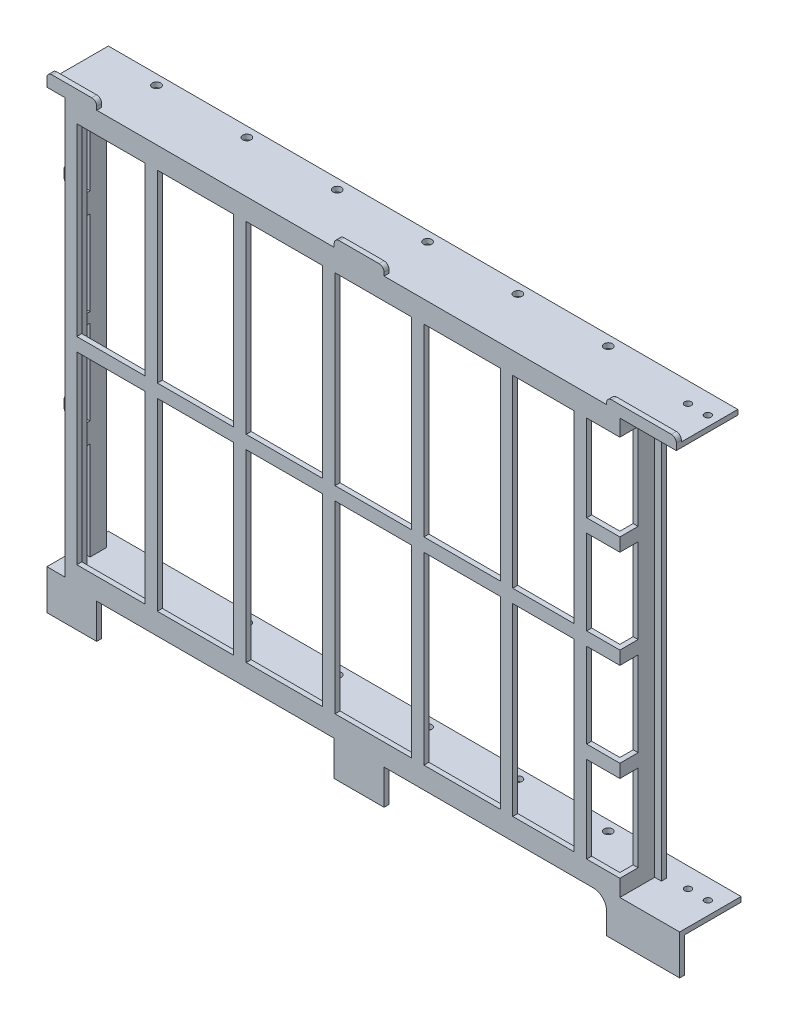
SolidWorks part; units mm, degrees
ref_plane "Plan de face" through (0, 0, 0) normal (0, 0, 1) x (1, 0, 0)
ref_plane "Plan de dessus" through (0, 0, 0) normal (0, 1, 0) x (1, 0, 0)
ref_plane "Plan de droite" through (0, 0, 0) normal (1, 0, 0) x (0, 0, -1)
sketch "Esquisse2" plane through (0, 0, 0) normal (0, 0, 1) x (1, 0, 0)
  line L0 (-80.4506, -55.1614) -> (-39.4506, -55.1614)
  line L1 (46.2661, 187.8386) -> (74.5494, 187.8386)
  line L2 (-87.4506, 184.8386) -> (-87.4506, -65.1614)
  line L3 (75.0494, -55.1614) -> (121.0494, -55.1614)
  line L4 (226.5494, 174.8386) -> (226.5494, 122.8386)
  line L5 (-80.4506, 174.8386) -> (-39.4506, 174.8386)
  line L6 (-80.4506, 174.8386) -> (-80.4506, 63.8386)
  line L7 (-31.9506, 174.8386) -> (14.0494, 174.8386)
  line L8 (219.0494, 174.8386) -> (219.0494, 63.8386)
  line L9 (219.0494, 55.8386) -> (182.0494, 55.8386)
  line L10 (21.5494, 174.8386) -> (67.5494, 174.8386)
  line L11 (219.0494, 63.8386) -> (182.0494, 63.8386)
  line L12 (74.5494, 187.8386) -> (74.5494, 189.8386)
  line L13 (77.5494, 192.8386) -> (101.5494, 192.8386)
  line L14 (67.5494, 174.8386) -> (67.5494, 63.8386)
  line L15 (104.5494, 187.8386) -> (104.5494, 189.8386)
  line L16 (75.0494, 174.8386) -> (75.0494, 63.8386)
  line L17 (-31.9506, -55.1614) -> (14.0494, -55.1614)
  line L18 (-39.4506, 174.8386) -> (-39.4506, 63.8386)
  line L20 (-31.9506, 174.8386) -> (-31.9506, 63.8386)
  line L22 (14.0494, 174.8386) -> (14.0494, 63.8386)
  line L24 (21.5494, 174.8386) -> (21.5494, 63.8386)
  line L25 (-39.4506, 63.8386) -> (-80.4506, 63.8386)
  line L26 (121.0494, 174.8386) -> (121.0494, 63.8386)
  line L27 (-39.4506, 55.8386) -> (-39.4506, -55.1614)
  line L28 (128.5494, 174.8386) -> (128.5494, 63.8386)
  line L30 (174.5494, 174.8386) -> (174.5494, 63.8386)
  line L31 (-31.9506, 55.8386) -> (-31.9506, -55.1614)
  line L32 (182.0494, 174.8386) -> (182.0494, 63.8386)
  line L33 (-39.4506, 55.8386) -> (-80.4506, 55.8386)
  line L34 (-80.4506, 55.8386) -> (-80.4506, -55.1614)
  line L35 (128.5494, -55.1614) -> (174.5494, -55.1614)
  line L36 (182.0494, -55.1614) -> (219.0494, -55.1614)
  line L37 (219.0494, 55.8386) -> (219.0494, -55.1614)
  line L38 (174.5494, 63.8386) -> (128.5494, 63.8386)
  line L39 (174.5494, 55.8386) -> (128.5494, 55.8386)
  line L40 (182.0494, 55.8386) -> (182.0494, -55.1614)
  line L41 (174.5494, 55.8386) -> (174.5494, -55.1614)
  line L42 (128.5494, 55.8386) -> (128.5494, -55.1614)
  line L43 (121.0494, 55.8386) -> (121.0494, -55.1614)
  line L44 (121.0494, 63.8386) -> (75.0494, 63.8386)
  line L45 (121.0494, 55.8386) -> (75.0494, 55.8386)
  line L46 (182.0494, 174.8386) -> (219.0494, 174.8386)
  line L47 (128.5494, 174.8386) -> (174.5494, 174.8386)
  line L48 (75.0494, 174.8386) -> (121.0494, 174.8386)
  line L50 (104.5494, 187.8386) -> (238.5494, 187.8386)
  line L51 (14.0494, 63.8386) -> (-31.9506, 63.8386)
  line L52 (21.5494, 55.8386) -> (21.5494, -55.1614)
  line L53 (14.0494, 55.8386) -> (-31.9506, 55.8386)
  line L54 (14.0494, 55.8386) -> (14.0494, -55.1614)
  line L55 (67.5494, 63.8386) -> (21.5494, 63.8386)
  line L56 (67.5494, 55.8386) -> (21.5494, 55.8386)
  line L57 (75.0494, 55.8386) -> (75.0494, -55.1614)
  line L58 (67.5494, 55.8386) -> (67.5494, -55.1614)
  line L59 (-68.4506, -68.1614) -> (74.5494, -68.1614)
  line L60 (21.5494, -55.1614) -> (67.5494, -55.1614)
  line L64 (46.2661, 187.8386) -> (-68.4506, 187.8386)
  line L68 (-87.4506, -65.1614) -> (-98.4506, -65.1614)
  line L69 (-98.4506, -65.1614) -> (-98.4506, -89.1614)
  line L70 (-98.4506, -89.1614) -> (-68.4506, -89.1614)
  line L71 (-98.4506, 189.8386) -> (-98.4506, 184.8386)
  line L72 (-95.4506, 192.8386) -> (-71.4506, 192.8386)
  line L73 (-68.4506, 189.8386) -> (-68.4506, 187.8386)
  line L75 (-68.4506, -89.1614) -> (-68.4506, -68.1614)
  line L76 (-98.4506, 184.8386) -> (-87.4506, 184.8386)
  line L79 (74.5494, -68.1614) -> (74.5494, -89.1614)
  line L80 (74.5494, -89.1614) -> (104.5494, -89.1614)
  line L81 (104.5494, -89.1614) -> (104.5494, -68.1614)
  line L83 (246.5494, 184.8386) -> (280.5494, 184.8386)
  line L84 (246.5494, 184.8386) -> (246.5494, 174.8386)
  line L85 (226.5494, 174.8386) -> (246.5494, 174.8386)
  line L86 (226.5494, -55.1614) -> (246.5494, -55.1614)
  line L87 (246.5494, -55.1614) -> (246.5494, -65.1614)
  line L88 (280.5494, 184.8386) -> (280.5494, 188.8386)
  line L89 (277.5494, 191.8386) -> (241.5494, 191.8386)
  line L90 (238.5494, 188.8386) -> (238.5494, 187.8386)
  line L91 (238.5494, -76.1614) -> (238.5494, -89.1614)
  line L92 (238.5494, -89.1614) -> (282.5494, -89.1614)
  line L93 (282.5494, -89.1614) -> (282.5494, -65.1614)
  line L94 (282.5494, -65.1614) -> (246.5494, -65.1614)
  line L95 (226.5494, 63.8386) -> (246.5494, 63.8386)
  line L96 (246.5494, 63.8386) -> (246.5494, 55.8386)
  line L97 (246.5494, 55.8386) -> (226.5494, 55.8386)
  line L98 (226.5494, 55.8386) -> (226.5494, 4.8386)
  line L99 (226.5494, 114.8386) -> (226.5494, 63.8386)
  line L100 (226.5494, 114.8386) -> (246.5494, 114.8386)
  line L101 (226.5494, -3.1614) -> (226.5494, -55.1614)
  line L102 (226.5494, 122.8386) -> (246.5494, 122.8386)
  line L103 (246.5494, 114.8386) -> (246.5494, 122.8386)
  line L104 (226.5494, 4.8386) -> (246.5494, 4.8386)
  line L105 (104.5494, -68.1614) -> (230.5494, -68.1614)
  line L106 (226.5494, -3.1614) -> (246.5494, -3.1614)
  line L107 (246.5494, 4.8386) -> (246.5494, -3.1614)
  arc A0 (241.5494, 191.8386) -> (238.5494, 188.8386) centre (241.5494, 188.8386) ccw
  arc A1 (277.5494, 191.8386) -> (280.5494, 188.8386) centre (277.5494, 188.8386) cw
  arc A2 (230.5494, -68.1614) -> (238.5494, -76.1614) centre (230.5494, -76.1614) cw
  arc A3 (74.5494, 189.8386) -> (77.5494, 192.8386) centre (77.5494, 189.8386) cw
  arc A4 (101.5494, 192.8386) -> (104.5494, 189.8386) centre (101.5494, 189.8386) cw
  arc A5 (-98.4506, 189.8386) -> (-95.4506, 192.8386) centre (-95.4506, 189.8386) cw
  arc A6 (-71.4506, 192.8386) -> (-68.4506, 189.8386) centre (-71.4506, 189.8386) cw
  point P82 (-98.4506, 192.8386)
  point P100 (280.5494, 191.8386)
  point P121 (74.5494, 192.8386)
  point P124 (104.5494, 192.8386)
  point P125 (-68.4506, 192.8386)
  dimension "D25" = 3
  dimension "D26" = 3
  dimension "D30" = 8
  dimension "D42" = 3
  dimension "D43" = 3
  dimension "D54" = 3
  dimension "D55" = 3
  dimension "D2" = 111
  dimension "D3" = 111
  dimension "D4" = 13
  dimension "D5" = 13
  dimension "D6" = 37
  dimension "D7" = 314
  dimension "D8" = 7.5
  dimension "D9" = 7.5
  dimension "D10" = 46
  dimension "D11" = 7.5
  dimension "D12" = 46
  dimension "D13" = 7.5
  dimension "D14" = 46
  dimension "D15" = 7.5
  dimension "D16" = 46
  dimension "D17" = 7.5
  dimension "D18" = 41
  dimension "D19" = 256
  dimension "D20" = 20
  dimension "D21" = 20
  dimension "D22" = 34
  dimension "D23" = 3
  dimension "D24" = 7
  dimension "D27" = 42
  dimension "D28" = 44
  dimension "D29" = 36
  dimension "D31" = 24
  dimension "D32" = 3
  dimension "D33" = 20
  dimension "D34" = 8
  dimension "D35" = 20
  dimension "D36" = 51
  dimension "D37" = 8
  dimension "D38" = 51
  dimension "D39" = 30
  dimension "D40" = 142
  dimension "D41" = 5
  dimension "D44" = 142
  dimension "D45" = 30
  dimension "D46" = 21
  dimension "D47" = 11
  dimension "D48" = 24
  dimension "D49" = 30
  dimension "D50" = 8
  dimension "D51" = 30
  dimension "D52" = 5
  dimension "D53" = 11
extrude "Boss.-Extru.1" add sketch "Esquisse2" along normal blind 3
sketch "Esquisse3" plane through (0, 0, 0) normal (0, 0, -1) x (-1, 0, 0)
  line L0 (98.4506, -65.1614) -> (98.4506, -89.1614) construction
  line L1 (-282.5494, -65.1614) -> (98.4506, -65.1614)
  line L2 (-282.5494, -65.1614) -> (-282.5494, -68.1614)
  line L3 (-282.5494, -68.1614) -> (98.4506, -68.1614)
  line L4 (98.4506, -65.1614) -> (98.4506, -68.1614)
  dimension "D1" = 3
extrude "Boss.-Extru.2" add sketch "Esquisse3" along normal blind 34
sketch "Esquisse4" plane through (0, 0, 0) normal (0, 0, -1) x (-1, 0, 0)
  line L0 (-280.5494, 184.8386) -> (-280.5494, 188.8386) construction
  line L1 (98.4506, 184.8386) -> (-280.5494, 184.8386)
  line L2 (98.4506, 184.8386) -> (98.4506, 187.8386)
  line L3 (98.4506, 187.8386) -> (-280.5494, 187.8386)
  line L4 (-280.5494, 184.8386) -> (-280.5494, 187.8386)
  dimension "D1" = 3
extrude "Boss.-Extru.3" add sketch "Esquisse4" along normal blind 34
sketch "Esquisse5" plane through (0, 0, 0) normal (0, 0, -1) x (-1, 0, 0)
  line L0 (87.4506, -65.1614) -> (-246.5494, -65.1614) construction
  line L1 (87.4506, 184.8386) -> (84.4506, 184.8386)
  line L2 (87.4506, 184.8386) -> (87.4506, -65.1614)
  line L3 (87.4506, -65.1614) -> (84.4506, -65.1614)
  line L4 (84.4506, 184.8386) -> (84.4506, -65.1614)
  dimension "D1" = 3
extrude "Boss.-Extru.4" add sketch "Esquisse5" along normal blind 7
sketch "Esquisse6" plane through (0, 0, 0) normal (0, 0, -1) x (-1, 0, 0)
  line L0 (-280.5494, 184.8386) -> (98.4506, 184.8386) construction
  line L1 (-246.5494, 174.8386) -> (-243.5494, 174.8386)
  line L2 (-246.5494, 174.8386) -> (-246.5494, 184.8386)
  line L3 (-246.5494, 184.8386) -> (-243.5494, 184.8386)
  line L4 (-243.5494, 174.8386) -> (-243.5494, 184.8386)
  line L5 (-246.5494, 122.8386) -> (-226.5494, 122.8386) construction
  line L6 (-246.5494, 114.8386) -> (-243.5494, 114.8386)
  line L7 (-246.5494, 114.8386) -> (-246.5494, 122.8386)
  line L8 (-246.5494, 122.8386) -> (-243.5494, 122.8386)
  line L9 (-243.5494, 114.8386) -> (-243.5494, 122.8386)
  line L10 (-226.5494, -3.1614) -> (-246.5494, -3.1614) construction
  line L11 (-246.5494, 55.8386) -> (-243.5494, 55.8386)
  line L12 (-246.5494, 55.8386) -> (-246.5494, 63.8386)
  line L13 (-246.5494, 63.8386) -> (-243.5494, 63.8386)
  line L14 (-243.5494, 55.8386) -> (-243.5494, 63.8386)
  line L15 (-246.5494, 4.8386) -> (-243.5494, 4.8386)
  line L16 (-246.5494, 4.8386) -> (-246.5494, -3.1614)
  line L17 (-246.5494, -3.1614) -> (-243.5494, -3.1614)
  line L18 (-243.5494, 4.8386) -> (-243.5494, -3.1614)
  line L19 (84.4506, -65.1614) -> (-246.5494, -65.1614) construction
  line L20 (-246.5494, -55.1614) -> (-243.5494, -55.1614)
  line L21 (-246.5494, -55.1614) -> (-246.5494, -65.1614)
  line L22 (-246.5494, -65.1614) -> (-243.5494, -65.1614)
  line L23 (-243.5494, -55.1614) -> (-243.5494, -65.1614)
  dimension "D1" = 3
extrude "Boss.-Extru.5" add sketch "Esquisse6" along normal blind 8
sketch "Esquisse7" plane through (0, 0, -8) normal (0, 0, -1) x (-1, 0, 0)
  line L0 (-280.5494, 184.8386) -> (98.4506, 184.8386) construction
  line L1 (-246.5494, -65.1614) -> (-243.5494, -65.1614)
  line L2 (-246.5494, -65.1614) -> (-246.5494, 184.8386)
  line L3 (-246.5494, 184.8386) -> (-243.5494, 184.8386)
  line L4 (-243.5494, -65.1614) -> (-243.5494, 184.8386)
  line L5 (-243.5494, 184.8386) -> (84.4506, 184.8386) construction
extrude "Boss.-Extru.6" add sketch "Esquisse7" along normal blind 13
sketch "Esquisse8" plane through (246.5494, 0, 0) normal (1, 0, 0) x (0, 0, -1)
  line L0 (-3, -65.1614) -> (21, -65.1614) construction
  line L1 (21, 184.8386) -> (18, 184.8386)
  line L2 (21, 184.8386) -> (21, -65.1614)
  line L3 (21, -65.1614) -> (18, -65.1614)
  line L4 (18, 184.8386) -> (18, -65.1614)
  dimension "D1" = 3
extrude "Boss.-Extru.7" add sketch "Esquisse8" along normal blind 4
sketch "Esquisse9" plane through (0, 184.8386, 0) normal (0, -1, 0) x (1, 0, 0)
  line L0 (280.5494, -34) -> (-98.4506, -34) construction
  line L1 (-93.4506, -22.3325) -> (-98.4506, -22.3325)
  line L2 (-93.4506, -22.3325) -> (-93.4506, -25)
  line L3 (-93.4506, -25) -> (-98.4506, -25)
  line L4 (-98.4506, -22.3325) -> (-98.4506, -25)
  line L5 (-98.4506, 3) -> (-98.4506, -34) construction
  dimension "D1" = 9
  dimension "D2" = 5
extrude "Boss.-Extru.8" add sketch "Esquisse9" along normal up to next
sketch "Esquisse10" plane through (-93.4506, 0, 0) normal (1, 0, 0) x (0, 0, -1)
  line L0 (-3, -65.1614) -> (18, -65.1614) construction
  line L1 (25, 184.8386) -> (15, 184.8386)
  line L2 (25, 184.8386) -> (25, -65.1614)
  line L3 (25, -65.1614) -> (15, -65.1614)
  line L4 (15, 184.8386) -> (15, -65.1614)
  dimension "D1" = 10
extrude "Boss.-Extru.9" add sketch "Esquisse10" along normal blind 3
sketch "Esquisse12" plane through (0, 0, -15) normal (0, 0, 1) x (1, 0, 0)
  line L0 (-93.4506, -65.1614) -> (-93.4506, 184.8386) construction
  line L1 (-93.4506, 5.8386) -> (-90.4506, 5.8386)
  line L2 (-93.4506, 5.8386) -> (-93.4506, -6.1614)
  line L3 (-93.4506, -6.1614) -> (-90.4506, -6.1614)
  line L4 (-90.4506, 5.8386) -> (-90.4506, -6.1614)
  line L5 (-90.4506, 184.8386) -> (-90.4506, -65.1614) construction
  line L6 (-98.4506, 184.8386) -> (-87.4506, 184.8386) construction
  line L7 (-93.4506, 62.8386) -> (-90.4506, 62.8386)
  line L8 (-93.4506, 62.8386) -> (-93.4506, 56.8386)
  line L9 (-93.4506, 56.8386) -> (-90.4506, 56.8386)
  line L10 (-90.4506, 62.8386) -> (-90.4506, 56.8386)
  line L11 (-93.4506, 125.8386) -> (-90.4506, 125.8386)
  line L12 (-93.4506, 125.8386) -> (-93.4506, 113.8386)
  line L13 (-93.4506, 113.8386) -> (-90.4506, 113.8386)
  line L14 (-90.4506, 125.8386) -> (-90.4506, 113.8386)
  line L15 (-87.4506, -65.1614) -> (-98.4506, -65.1614) construction
  dimension "D1" = 59
  dimension "D2" = 12
  dimension "D3" = 59
  dimension "D4" = 12
  dimension "D5" = 51
  dimension "D6" = 51
extrude "Boss.-Extru.10" add sketch "Esquisse12" along normal blind 10
sketch "Esquisse13" plane through (-90.4506, 0, 0) normal (1, 0, 0) x (0, 0, -1)
  line L0 (5, 113.8386) -> (15, 113.8386) construction
  line L1 (5, 125.8386) -> (8, 125.8386)
  line L2 (5, 125.8386) -> (5, 113.8386)
  line L3 (5, 113.8386) -> (8, 113.8386)
  line L4 (8, 125.8386) -> (8, 113.8386)
  line L5 (5, 56.8386) -> (15, 56.8386) construction
  line L6 (5, 62.8386) -> (8, 62.8386)
  line L7 (5, 62.8386) -> (5, 56.8386)
  line L8 (5, 56.8386) -> (8, 56.8386)
  line L9 (8, 62.8386) -> (8, 56.8386)
  line L10 (5, -6.1614) -> (15, -6.1614) construction
  line L11 (5, 5.8386) -> (8, 5.8386)
  line L12 (5, 5.8386) -> (5, -6.1614)
  line L13 (5, -6.1614) -> (8, -6.1614)
  line L14 (8, 5.8386) -> (8, -6.1614)
  dimension "D1" = 3
extrude "Boss.-Extru.12" add sketch "Esquisse13" along normal blind 3.61
sketch "Esquisse14" plane through (-98.4506, 0, 0) normal (-1, 0, 0) x (0, 0, 1)
  line L0 (-25, -65.1614) -> (-25, 184.8386) construction
  line L1 (-25, 125.8386) -> (-22.3325, 125.8386)
  line L2 (-25, 125.8386) -> (-25, 113.8386)
  line L3 (-25, 113.8386) -> (-22.3325, 113.8386)
  line L4 (-22.3325, 125.8386) -> (-22.3325, 113.8386)
  line L5 (-22.3325, -65.1614) -> (-22.3325, 184.8386) construction
  line L6 (-22.3325, -65.1614) -> (-22.3325, 184.8386) construction
  line L7 (-25, 5.8386) -> (-22.3325, 5.8386)
  line L8 (-25, 5.8386) -> (-25, -6.1614)
  line L9 (-25, -6.1614) -> (-22.3325, -6.1614)
  line L10 (-22.3325, 5.8386) -> (-22.3325, -6.1614)
  line L11 (-25, -65.1614) -> (-34, -65.1614) construction
  dimension "D1" = 12
  dimension "D2" = 59
  dimension "D3" = 12
  dimension "D4" = 59
extrude "Boss.-Extru.13" add sketch "Esquisse14" along normal blind 15
fillet "Congé1" radius 4 1 edges at (-113.4506, 125.8386, -23.6663)
fillet "Congé2" radius 4 1 edges at (-113.4506, 113.8386, -23.6663)
fillet "Congé3" radius 4 2 edges at (-113.4506, 5.8386, -23.6663) (-113.4506, -6.1614, -23.6663)
sketch "Esquisse15" plane through (0, -68.1614, 0) normal (0, -1, 0) x (1, 0, 0)
  line L0 (333.1911, -28) -> (-183.765, -28) construction
  line L1 (282.5494, -34) -> (-98.4506, -34) construction
  line L2 (282.5494, -34) -> (282.5494, 0) construction
  circle A0 centre (208.5494, -28) radius 2.5
  circle A1 centre (154.1494, -28) radius 2.5
  circle A2 centre (99.7494, -28) radius 2.5
  circle A3 centre (45.3494, -28) radius 2.5
  circle A4 centre (-9.0506, -28) radius 2.5
  circle A5 centre (-63.4506, -28) radius 2.5
  circle A6 centre (274.5494, -22) radius 2
  circle A7 centre (262.5494, -22) radius 2
  dimension "D2" = 74
  dimension "D4" = 12
  dimension "D1" = 6
  dimension "D5" = 8
  dimension "D6" = 12
  dimension "D3" = 6
extrude "Enlèv. mat.-Extru.1" cut sketch "Esquisse15" against normal through all
